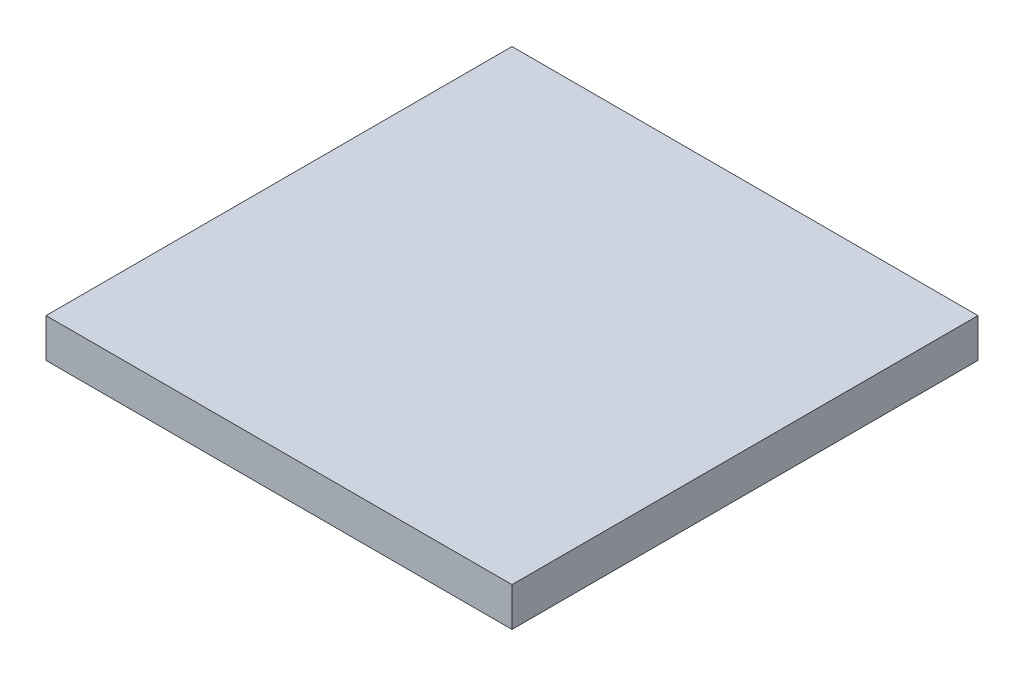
SolidWorks part; units mm, degrees
ref_plane "Plan de face" through (0, 0, 0) normal (0, 0, 1) x (1, 0, 0)
ref_plane "Plan de dessus" through (0, 0, 0) normal (0, 1, 0) x (1, 0, 0)
ref_plane "Plan de droite" through (0, 0, 0) normal (1, 0, 0) x (0, 0, -1)
sketch "Esquisse1" plane through (0, 0, 0) normal (0, 1, 0) x (1, 0, 0)
  line L1 (0, 0) -> (60, 0)
  line L2 (0, 0) -> (0, 60)
  line L3 (0, 60) -> (60, 60)
  line L4 (60, 0) -> (60, 60)
  dimension "D1" = 60
  dimension "D2" = 60
extrude "Extrusion1" add sketch "Esquisse1" along normal blind 5
